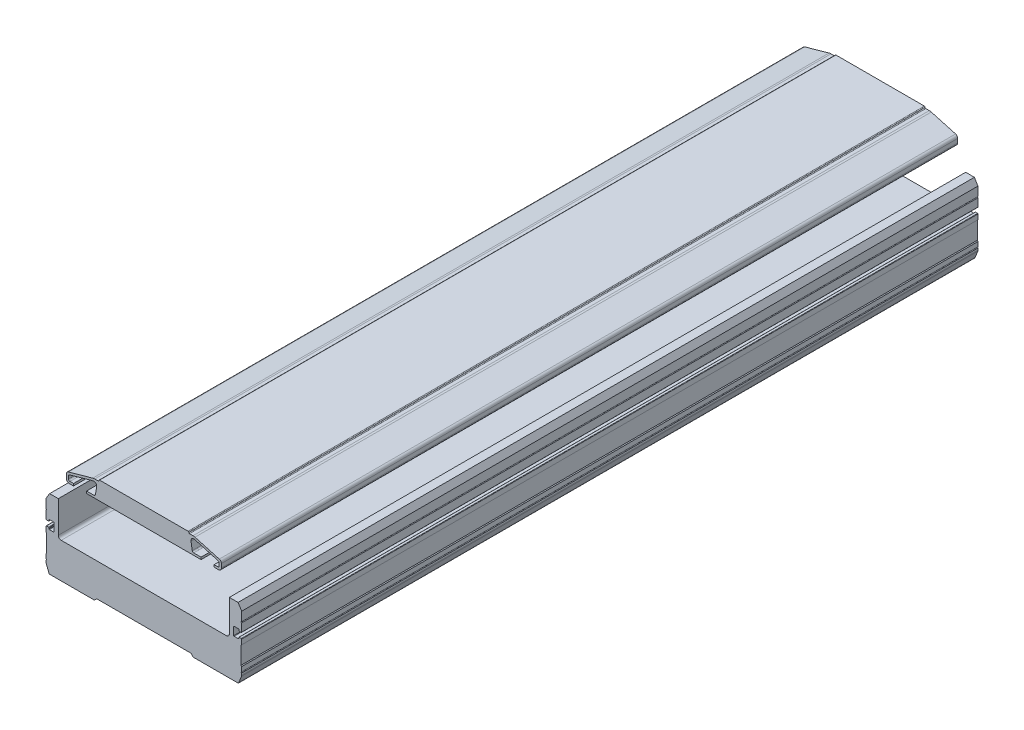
SolidWorks part; units mm, degrees
ref_plane "前视基准面" through (0, 0, 0) normal (0, 0, 1) x (1, 0, 0)
ref_plane "上视基准面" through (0, 0, 0) normal (0, 1, 0) x (1, 0, 0)
ref_plane "右视基准面" through (0, 0, 0) normal (1, 0, 0) x (0, 0, -1)
sketch "草图1" plane through (0, 0, 0) normal (0, 0, 1) x (1, 0, 0)
  line B0 (-51.5, 59.4) -> (-48.5, 59.4)
  line B1 (-48.5, 59.4) -> (-48.5, 60.9)
  line B2 (-48.5, 60.9) -> (-51, 60.9)
  line B3 (-52, 61.9) -> (-52, 63.7046)
  line B4 (-51.27, 64.6675) -> (-35.0485, 69.2164)
  line B5 (-32.5361, 66.9593) -> (-33.4138, 61.7343)
  line B6 (-34.4, 60.9) -> (-39.5, 60.9)
  line B7 (-39.5, 60.9) -> (-39.5, 59.4)
  line B8 (-39.5, 59.4) -> (39.5, 59.4)
  line B9 (39.5, 59.4) -> (39.5, 60.9)
  line B10 (39.5, 60.9) -> (34.4, 60.9)
  line B11 (33.4138, 61.7343) -> (32.5361, 66.9593)
  line B12 (35.0485, 69.2164) -> (51.27, 64.6675)
  line B13 (52, 63.7046) -> (52, 61.9)
  line B14 (51, 60.9) -> (48.5, 60.9)
  line B15 (48.5, 60.9) -> (48.5, 59.4)
  line B16 (48.5, 59.4) -> (51.5, 59.4)
  line B17 (53.5, 61.4) -> (53.5, 64.0837)
  line B18 (52.04, 66.0094) -> (35.2622, 70.7143)
  line B19 (33.9122, 70.9) -> (31.5, 70.9)
  line B20 (30.5, 71.9) -> (-30.5, 71.9)
  line B21 (-31.5, 70.9) -> (-33.9122, 70.9)
  line B22 (-35.2622, 70.7143) -> (-52.04, 66.0094)
  line B23 (-53.5, 64.0837) -> (-53.5, 61.4)
  line B24 (-65.16, -1.6) -> (-34.1, -1.6)
  line B25 (-34.1, -1.6) -> (-32.5, 0)
  line B26 (-32.5, 0) -> (32.5, 0)
  line B27 (32.5, 0) -> (34.1, -1.6)
  line B28 (34.1, -1.6) -> (65.16, -1.6)
  line B29 (65.5064, -1.0289) -> (67.36, 3.6468)
  line B30 (67.5, 4.3812) -> (67.5, 5.625)
  line B31 (67.5, 6.375) -> (67.5, 9.5)
  line B32 (67.5, 9.5) -> (67, 10)
  line B33 (67, 10) -> (67, 22)
  line B34 (67, 22) -> (67.5, 22.5)
  line B35 (67.5, 22.5) -> (67.5, 25.9)
  line B36 (67.2, 26.2) -> (65.8, 26.2)
  line B37 (65.5, 25.9) -> (65.5, 25.3)
  line B38 (65.2, 25) -> (62.3, 25)
  line B39 (62, 25.3) -> (62, 30.7)
  line B40 (62.3, 31) -> (65.2, 31)
  line B41 (65.5, 30.7) -> (65.5, 30.1)
  line B42 (65.8, 29.8) -> (67.2, 29.8)
  line B43 (67.5, 30.1) -> (67.5, 35.625)
  line B44 (67.5, 36.375) -> (67.5, 42.6)
  line B45 (67.5, 42.6) -> (65, 46.6)
  line B46 (65, 46.6) -> (59, 46.6)
  line B47 (59, 46.6) -> (59, 24.7)
  line B48 (57, 22.7) -> (-57, 22.7)
  line B49 (-59, 24.7) -> (-59, 46.6)
  line B50 (-59, 46.6) -> (-65, 46.6)
  line B51 (-65, 46.6) -> (-67.5, 42.6)
  line B52 (-67.5, 42.6) -> (-67.5, 36.375)
  line B53 (-67.5, 35.625) -> (-67.5, 30.1)
  line B54 (-67.2, 29.8) -> (-65.8, 29.8)
  line B55 (-65.5, 30.1) -> (-65.5, 30.7)
  line B56 (-65.2, 31) -> (-62.3, 31)
  line B57 (-62, 30.7) -> (-62, 25.3)
  line B58 (-62.3, 25) -> (-65.2, 25)
  line B59 (-65.5, 25.3) -> (-65.5, 25.9)
  line B60 (-65.8, 26.2) -> (-67.2, 26.2)
  line B61 (-67.5, 25.9) -> (-67.5, 22.5)
  line B62 (-67.5, 22.5) -> (-67, 22)
  line B63 (-67, 22) -> (-67, 10)
  line B64 (-67, 10) -> (-67.5, 9.5)
  line B65 (-67.5, 9.5) -> (-67.5, 6.375)
  line B66 (-67.5, 5.625) -> (-67.5, 4.3812)
  line B67 (-67.36, 3.6468) -> (-65.5064, -1.0289)
  arc B68 (-53.5, 61.4) -> (-51.5, 59.4) centre (-51.5, 61.4) ccw
  arc B69 (-52, 61.9) -> (-51, 60.9) centre (-51, 61.9) ccw
  arc B70 (-51.27, 64.6675) -> (-52, 63.7046) centre (-51, 63.7046) ccw
  arc B71 (-32.5361, 66.9593) -> (-35.0485, 69.2164) centre (-34.5085, 67.2906) ccw
  arc B72 (-34.4, 60.9) -> (-33.4138, 61.7343) centre (-34.4, 61.9) ccw
  arc B73 (33.4138, 61.7343) -> (34.4, 60.9) centre (34.4, 61.9) ccw
  arc B74 (35.0485, 69.2164) -> (32.5361, 66.9593) centre (34.5085, 67.2906) ccw
  arc B75 (52, 63.7046) -> (51.27, 64.6675) centre (51, 63.7046) ccw
  arc B76 (51, 60.9) -> (52, 61.9) centre (51, 61.9) ccw
  arc B77 (51.5, 59.4) -> (53.5, 61.4) centre (51.5, 61.4) ccw
  arc B78 (53.5, 64.0837) -> (52.04, 66.0094) centre (51.5, 64.0837) ccw
  arc B79 (35.2622, 70.7143) -> (33.9122, 70.9) centre (33.9122, 65.9) ccw
  arc B80 (31, 71.4) -> (31.5, 70.9) centre (31.5, 71.4) ccw
  arc B81 (31, 71.4) -> (30.5, 71.9) centre (30.5, 71.4) ccw
  arc B82 (-30.5, 71.9) -> (-31, 71.4) centre (-30.5, 71.4) ccw
  arc B83 (-31.5, 70.9) -> (-31, 71.4) centre (-31.5, 71.4) ccw
  arc B84 (-33.9122, 70.9) -> (-35.2622, 70.7143) centre (-33.9122, 65.9) ccw
  arc B85 (-52.04, 66.0094) -> (-53.5, 64.0837) centre (-51.5, 64.0837) ccw
  arc B86 (-65.5064, -1.0289) -> (-65.16, -1.6) centre (-63.6472, -0.2918) ccw
  arc B87 (65.16, -1.6) -> (65.5064, -1.0289) centre (63.6472, -0.2918) ccw
  arc B88 (67.36, 3.6468) -> (67.5, 4.3812) centre (65.5, 4.382) ccw
  arc B89 (67.5, 6.375) -> (67.5, 5.625) centre (67.5, 6) ccw
  arc B90 (67.5, 25.9) -> (67.2, 26.2) centre (67.2, 25.9) ccw
  arc B91 (65.8, 26.2) -> (65.5, 25.9) centre (65.8, 25.9) ccw
  arc B92 (65.2, 25) -> (65.5, 25.3) centre (65.2, 25.3) ccw
  arc B93 (62, 25.3) -> (62.3, 25) centre (62.3, 25.3) ccw
  arc B94 (62.3, 31) -> (62, 30.7) centre (62.3, 30.7) ccw
  arc B95 (65.5, 30.7) -> (65.2, 31) centre (65.2, 30.7) ccw
  arc B96 (65.5, 30.1) -> (65.8, 29.8) centre (65.8, 30.1) ccw
  arc B97 (67.2, 29.8) -> (67.5, 30.1) centre (67.2, 30.1) ccw
  arc B98 (67.5, 36.375) -> (67.5, 35.625) centre (67.5, 36) ccw
  arc B99 (57, 22.7) -> (59, 24.7) centre (57, 24.7) ccw
  arc B100 (-59, 24.7) -> (-57, 22.7) centre (-57, 24.7) ccw
  arc B101 (-67.5, 35.625) -> (-67.5, 36.375) centre (-67.5, 36) ccw
  arc B102 (-67.5, 30.1) -> (-67.2, 29.8) centre (-67.2, 30.1) ccw
  arc B103 (-65.8, 29.8) -> (-65.5, 30.1) centre (-65.8, 30.1) ccw
  arc B104 (-65.2, 31) -> (-65.5, 30.7) centre (-65.2, 30.7) ccw
  arc B105 (-62, 30.7) -> (-62.3, 31) centre (-62.3, 30.7) ccw
  arc B106 (-62.3, 25) -> (-62, 25.3) centre (-62.3, 25.3) ccw
  arc B107 (-65.5, 25.3) -> (-65.2, 25) centre (-65.2, 25.3) ccw
  arc B108 (-65.5, 25.9) -> (-65.8, 26.2) centre (-65.8, 25.9) ccw
  arc B109 (-67.2, 26.2) -> (-67.5, 25.9) centre (-67.2, 25.9) ccw
  arc B110 (-67.5, 5.625) -> (-67.5, 6.375) centre (-67.5, 6) ccw
  arc B111 (-67.5, 4.3812) -> (-67.36, 3.6468) centre (-65.5, 4.382) ccw
sketch_block_instance "块24-1"
sketch_block "块24"
extrude "凸台-拉伸1" add sketch "草图1" along normal blind 508
hole_wizard "打孔尺寸(%根据)内六角圆柱头螺钉的类型1" positions "草图7" profile "草图5" counterbore size "M6" standard "GB"
sketch "草图7" plane through (0, 46.6, 0) normal (0, 1, 0) x (1, 0, 0)
  line L0 (0, 0) -> (0, -383.8232) construction
  line L3 (-65.16, 0) -> (-34.1, 0) construction
  point P0 (-53, -61.5)
  point P8 (-53, -261.5)
  point P10 (-53, -1061.5)
  point P12 (-53, -661.5)
  point P14 (-53, -461.5)
  point P16 (-53, -1261.5)
  point P18 (-53, -861.5)
  point P34 (53, -861.5)
  point P35 (53, -1261.5)
  point P36 (53, -461.5)
  point P37 (53, -661.5)
  point P38 (53, -1061.5)
  point P39 (53, -261.5)
  point P40 (53, -61.5)
  dimension "D1" = 106
  dimension "D2" = 61.5
  dimension "D3" = 200
  dimension "D4" = 200
  dimension "D5" = 200
  dimension "D6" = 200
  dimension "D7" = 200
  dimension "D8" = 200
sketch "草图5" plane through (-53, 46.6, 61.5) normal (1, 0, 0) x (0, 0, 1)
  line L0 (0, 0) -> (0, 48.2)
  line L1 (0, 48.2) -> (3.5, 48.2)
  line L3 (3.5, 48.2) -> (3.5, 40.9)
  line L4 (3.5, 40.9) -> (5.5, 40.9)
  line L5 (5.5, 40.9) -> (5.5, 0)
  line L7 (5.5, 0) -> (0, 0)
  line L11 (0, -6.35) -> (0, 107.95) construction
  dimension "通孔孔直径" = 7
  dimension "通孔孔深度" = 48.2
  dimension "柱形沉头孔直径" = 11
  dimension "柱形沉头孔深度" = 40.9
hole_wizard "M6 螺纹孔1" positions "草图8" profile "草图9" tap size "M6" standard "GB"
sketch "草图8" plane through (0, -1.6, 0) normal (0, -1, 0) x (-1, 0, 0)
  line L0 (0, 0) -> (0, -43.6644) construction
  line L3 (-34.1, 0) -> (-65.16, 0) construction
  point P0 (-53, -51.5)
  point P7 (53, -51.5)
  point P10 (-53, -251.5)
  point P12 (-53, -451.5)
  point P14 (-53, -651.5)
  point P18 (-53, -851.5)
  point P20 (-53, -1051.5)
  point P21 (53, -1051.5)
  point P22 (53, -851.5)
  point P23 (53, -651.5)
  point P24 (53, -451.5)
  point P25 (53, -251.5)
  point P28 (-53, -1251.5)
  point P34 (53, -1251.5)
  dimension "D1" = 106
  dimension "D2" = 51.5
  dimension "D3" = 200
  dimension "D4" = 200
  dimension "D5" = 200
  dimension "D6" = 200
  dimension "D7" = 200
  dimension "D8" = 200
sketch "草图9" plane through (53, -1.6, 51.5) normal (1, 0, 0) x (0, 0, -1)
  line L0 (0, 0) -> (0, 12.5022)
  line L1 (0, 12.5022) -> (2.5, 11)
  line L2 (2.5, 11) -> (2.5, 0)
  line L5 (2.5, 0) -> (0, 0)
  line L10 (0, 12.5022) -> (-2.5, 11) construction
  line L11 (0, -6.35) -> (0, 107.95) construction
  dimension "螺纹孔钻头直径" = 5
  dimension "螺纹孔钻头深度" = 11
  dimension "导头角度" = 118
